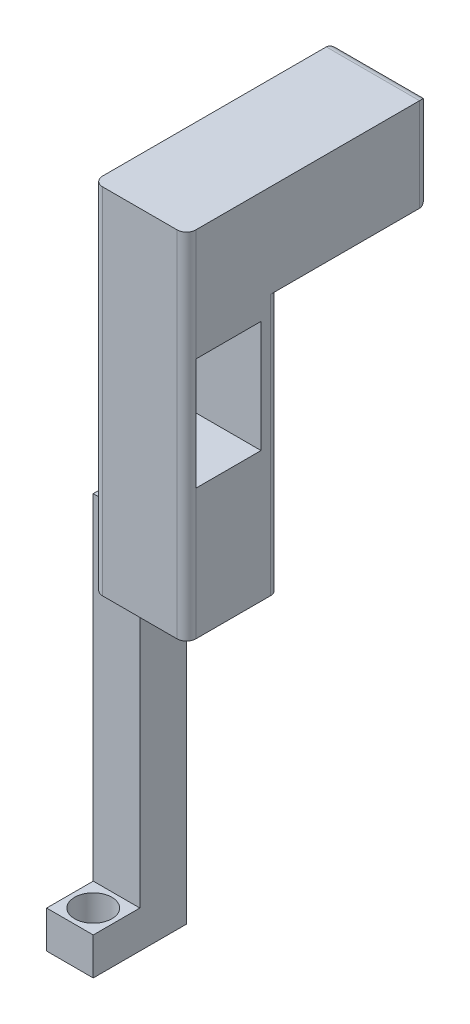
SolidWorks part; units mm, degrees
ref_plane "Front Plane" through (0, 0, 0) normal (0, 0, 1) x (1, 0, 0)
ref_plane "Top Plane" through (0, 0, 0) normal (0, 1, 0) x (1, 0, 0)
ref_plane "Right Plane" through (0, 0, 0) normal (1, 0, 0) x (0, 0, -1)
sketch "Sketch1" plane through (0, 0, 0) normal (0, 1, 0) x (1, 0, 0)
  line L1 (-3.75, 2.5) -> (3.75, 2.5)
  line L2 (-3.75, 2.5) -> (-3.75, -2.5)
  line L3 (-3.75, -2.5) -> (3.75, -2.5)
  line L4 (3.75, 2.5) -> (3.75, -2.5)
  line L5 (-3.75, 2.5) -> (3.75, -2.5) construction
  line L6 (-3.75, -2.5) -> (3.75, 2.5) construction
  point P0 (0, 0)
  dimension "D1" = 7.5
  dimension "D2" = 5
extrude "Boss-Extrude1" add sketch "Sketch1" along normal blind 2
sketch "Sketch2" plane through (0, 2, 0) normal (0, 1, 0) x (1, 0, 0)
  line L4 (3.75, 2.5) -> (-1.25, 2.5)
  line L5 (3.75, 2.5) -> (3.75, -2.5)
  line L6 (3.75, -2.5) -> (-1.25, -2.5)
  line L7 (3.75, -2.5) -> (3.75, 2.5)
  line L13 (3.75, 2.5) -> (-3.75, 2.5)
  line L14 (-3.75, 2.5) -> (-3.75, -2.5)
  line L15 (-3.75, -2.5) -> (3.75, -2.5)
  line L16 (3.75, -2.5) -> (3.75, 2.5)
  line L17 (3.75, 2.5) -> (-3.75, 2.5)
  line L18 (-3.75, 2.5) -> (-3.75, -2.5)
  line L19 (-3.75, -2.5) -> (3.75, -2.5)
  line L20 (-1.25, 2.5) -> (-1.25, -2.5)
  line L21 (3.75, 2.5) -> (-1.25, -2.5) construction
  line L22 (3.75, -2.5) -> (-1.25, 2.5) construction
  point P6 (-1.25, 0)
  point P7 (1.25, 0)
  dimension "D2" = 5
  dimension "D1" = 0
extrude "Boss-Extrude5" add sketch "Sketch2" along normal blind 17 contours L20 M7 M9 M6
sketch "Sketch8" plane through (0, 0, -2.5) normal (0, 0, -1) x (-1, 0, 0)
  line L1 (-3.75, 19) -> (1.25, 19)
  line L2 (-3.75, 19) -> (-3.75, 14)
  line L3 (-3.75, 14) -> (1.25, 14)
  line L4 (1.25, 19) -> (1.25, 14)
  line L5 (-3.75, 19) -> (1.25, 14) construction
  line L6 (-3.75, 0) -> (3.75, 0)
  line L7 (3.75, 0) -> (3.75, 2)
  line L8 (3.75, 2) -> (1.25, 2)
  line L9 (1.25, 2) -> (1.25, 19)
  line L10 (1.25, 19) -> (-3.75, 19)
  line L11 (-3.75, 19) -> (-3.75, 0)
  line L12 (-3.75, 0) -> (3.75, 0)
  line L13 (3.75, 0) -> (3.75, 2)
  line L14 (3.75, 2) -> (1.25, 2)
  line L15 (1.25, 2) -> (1.25, 19)
  line L16 (1.25, 19) -> (-3.75, 19)
  line L17 (-3.75, 19) -> (-3.75, 0)
  line L18 (-3.75, 14) -> (1.25, 19) construction
  point P6 (-1.25, 16.5)
  dimension "D2" = 5
  dimension "D1" = 0
extrude "Boss-Extrude6" add sketch "Sketch8" along normal blind 8 contours L3 M15 M13 M14
sketch "Sketch9" plane through (0, 0, 0) normal (0, -1, 0) x (1, 0, 0)
  line L1 (-3.75, 2.5) -> (-1.25, 2.5)
  line L2 (-3.75, 2.5) -> (-3.75, -2.5)
  line L3 (-3.75, -2.5) -> (-1.25, -2.5)
  line L4 (3.75, -2.5) -> (3.75, 2.5)
  line L5 (3.75, 2.5) -> (-3.75, 2.5)
  line L6 (-3.75, 2.5) -> (-3.75, -2.5)
  line L7 (-3.75, -2.5) -> (3.75, -2.5)
  line L8 (3.75, -2.5) -> (3.75, 2.5)
  line L9 (3.75, 2.5) -> (-3.75, 2.5)
  line L10 (-3.75, 2.5) -> (-3.75, -2.5)
  line L11 (-3.75, -2.5) -> (3.75, -2.5)
  line L12 (-1.25, 2.5) -> (-1.25, -2.5)
  line L13 (-3.75, 2.5) -> (-1.25, -2.5) construction
  line L14 (-3.75, -2.5) -> (-1.25, 2.5) construction
  point P6 (-2.5, 0)
  dimension "D1" = 0
extrude "Boss-Extrude7" add sketch "Sketch9" along normal blind 18 contours L12 M6 M7 M8
sketch "Sketch10" plane through (-3.75, 0, 0) normal (-1, 0, 0) x (0, 0, 1)
  line L1 (2.5, 2) -> (0, 2)
  line L2 (2.5, 2) -> (2.5, -16)
  line L3 (2.5, -16) -> (0, -16)
  line L4 (-2.5, 2) -> (-2.5, -18)
  line L5 (-2.5, -18) -> (2.5, -18)
  line L6 (2.5, -18) -> (2.5, 2)
  line L7 (2.5, 2) -> (-2.5, 2)
  line L8 (-2.5, 2) -> (-2.5, -18)
  line L9 (-2.5, -18) -> (2.5, -18)
  line L10 (2.5, -18) -> (2.5, 2)
  line L11 (2.5, 2) -> (-2.5, 2)
  line L12 (0, 2) -> (0, -16)
  line L13 (2.5, 2) -> (0, -16) construction
  line L14 (2.5, -16) -> (0, 2) construction
  point P7 (1.25, -7)
  dimension "D2" = 2
  dimension "D1" = 0
extrude "Cut-Extrude4" cut sketch "Sketch10" against normal blind 2.5 contours L12 L3 M9 M8
sketch "Sketch11" plane through (0, -16, 0) normal (0, 1, 0) x (1, 0, 0)
  line L0 (-3.75, -1.25) -> (-1.25, -1.25) construction
  line L4 (-3.75, 0) -> (-3.75, -2.5)
  line L5 (-3.75, -2.5) -> (-1.25, -2.5)
  line L6 (-1.25, -2.5) -> (-1.25, 0)
  line L7 (-1.25, 0) -> (-3.75, 0)
  line L8 (-3.75, 0) -> (-3.75, -2.5)
  line L9 (-3.75, -2.5) -> (-1.25, -2.5)
  line L10 (-1.25, -2.5) -> (-1.25, 0)
  line L11 (-1.25, 0) -> (-3.75, 0)
  circle A0 centre (-2.5, -1.25) radius 1
  dimension "D1" = 0
extrude "Cut-Extrude5" cut sketch "Sketch11" against normal blind 2.5 contours L0 A0 | A0 L0
fillet "Fillet2" radius 0.5 8 edges at (1.25, 14, -10.5) (1.25, 19, -10.5) (3.75, 16.5, -10.5) (-1.25, 16.5, -10.5) (3.75, 7, -2.5) (3.75, 9.5, 2.5) (-1.25, 8, -2.5) (-1.25, 9.5, 2.5)
sketch "Sketch12" plane through (-1.25, 0, 0) normal (-1, 0, 0) x (0, 0, 1)
  line L1 (2, 13) -> (-1.5, 13)
  line L2 (2, 13) -> (2, 7)
  line L3 (2, 7) -> (-1.5, 7)
  line L4 (-1.5, 13) -> (-1.5, 7)
  line L5 (2, 13) -> (-1.5, 7) construction
  line L6 (2, 7) -> (-1.5, 13) construction
  line L8 (2, 19) -> (-10, 19)
  line L9 (-10, 19) -> (-10, 14)
  line L10 (-10, 14) -> (-2, 14)
  line L11 (-2, 14) -> (-2, 2)
  line L12 (-2, 2) -> (0, 2)
  line L13 (0, 2) -> (0, 0)
  line L14 (0, 0) -> (2, 0)
  line L15 (2, 0) -> (2, 19)
  line L16 (2, 19) -> (-10, 19)
  line L17 (-10, 19) -> (-10, 14)
  line L18 (-10, 14) -> (-2, 14)
  line L19 (-2, 14) -> (-2, 2)
  line L20 (-2, 2) -> (0, 2)
  line L21 (0, 2) -> (0, 0)
  line L22 (0, 0) -> (2, 0)
  line L23 (2, 0) -> (2, 19)
  point P10 (0.25, 10)
  dimension "D2" = 6
  dimension "D3" = 6
  dimension "D4" = 3.5
  dimension "D1" = 0
extrude "Cut-Extrude6" cut sketch "Sketch12" against normal blind 5 contours L1 L4 L3 M19
